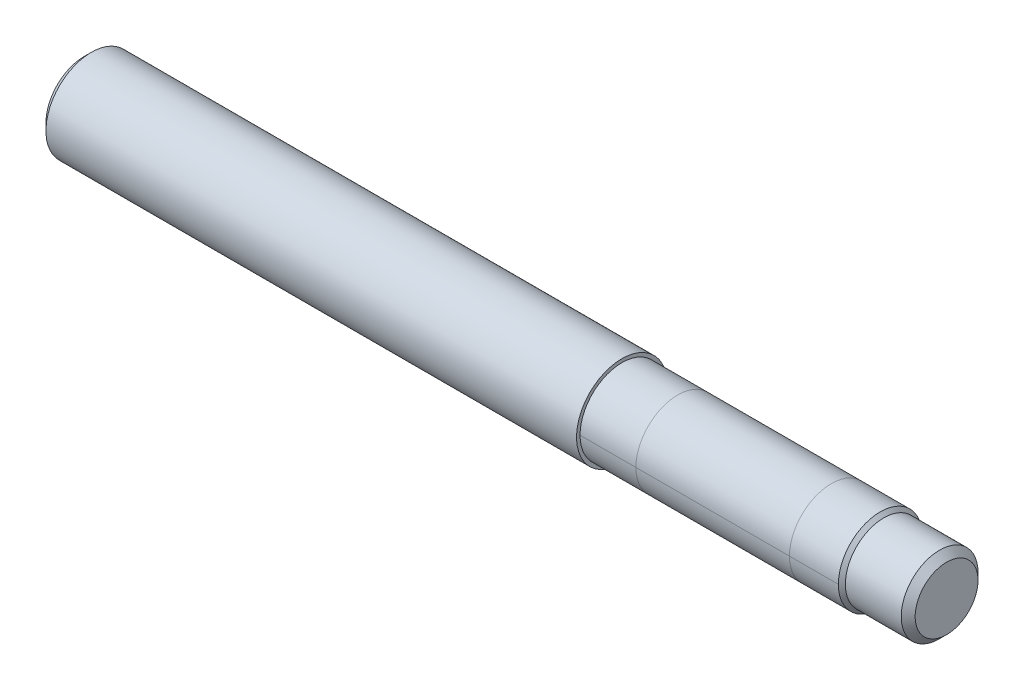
SolidWorks part; units mm, degrees
ref_plane "Front" through (0, 0, 0) normal (0, 0, 1) x (1, 0, 0)
ref_plane "Top" through (0, 0, 0) normal (0, 1, 0) x (1, 0, 0)
ref_plane "Right" through (0, 0, 0) normal (1, 0, 0) x (0, 0, -1)
sketch "Sketch1" plane through (0, 0, 0) normal (1, 0, 0) x (0, 0, -1)
  circle A0 centre (0, 0) radius 6.5
  dimension "D1" = 13
extrude "Extrude1" add sketch "Sketch1" along normal blind 123.5
sketch "Sketch2" plane through (123.5, 0, 0) normal (1, 0, 0) x (0, 0, -1)
  circle A0 centre (0, 0) radius 6
  dimension "D1" = 12
extrude "Cut-Extrude1" cut sketch "Sketch2" against normal blind 46.5 flip side to cut
sketch "Sketch3" plane through (0, 0, 0) normal (0, 0, 1) x (1, 0, 0)
  line L0 (123.5, 10.254) -> (123.5, 5.5)
  line L1 (123.5, 5.5) -> (114.5, 5.5)
  line L2 (114.5, 5.5) -> (112.6001, 7.3999)
  line L3 (112.6001, 7.3999) -> (112.6001, 10.254)
  line L4 (112.6001, 10.254) -> (123.5, 10.254)
  line L5 (123.5, -6) -> (123.5, 6) construction
  line L6 (127.965, 0) -> (95.5626, 0) construction
  line L7 (77, 0) -> (0, 0) construction
  dimension "D1" = 11
  dimension "D2" = 9
  dimension "D3" = 45
revolve "Cut-Revolve1" cut sketch "Sketch3" angle 360 about L6
chamfer "Chamfer1" distance 1 angle 45 2 edges at (123.5, 0, -5.5) (0, 0, -6.5)
sketch "Sketch5" plane through (0, 0, 0) normal (0, 0, 1) x (1, 0, 0)
  line L0 (77, 0) -> (114, 0)
  line L1 (77, -6.5) -> (77, 6.5) construction
  line L2 (114, -6) -> (114, 6) construction
sketch "Sketch6" plane through (0, 0, 0) normal (0, 0, 1) x (1, 0, 0)
  line L0 (85.001, 6) -> (85.001, -6)
  line L1 (114, 6) -> (77, 6) construction
  line L2 (77, -6) -> (114, -6) construction
  line L3 (77, -6.5) -> (77, 6.5) construction
  dimension "D1" = 8.001
sketch "Sketch7" plane through (0, 0, 0) normal (0, 0, 1) x (1, 0, 0)
  line L0 (106.9974, 6) -> (106.9974, -6)
  line L3 (77, -6.5) -> (77, 6.5) construction
  dimension "D1" = 29.9974
